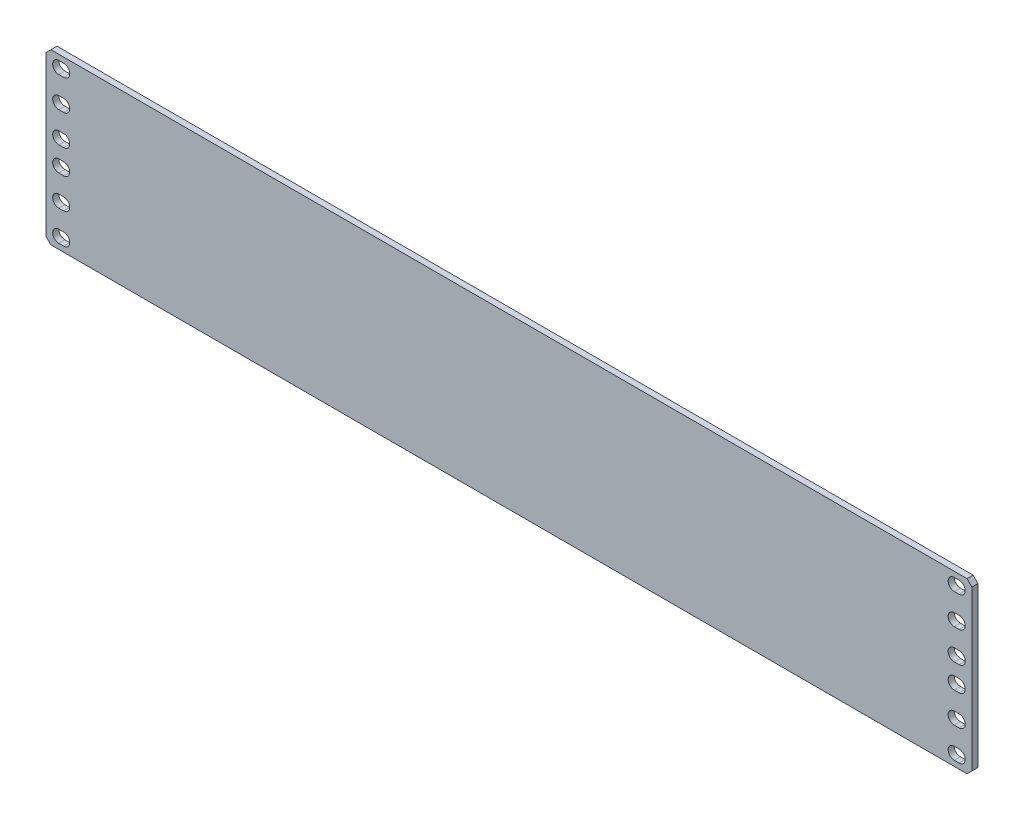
SolidWorks part; units mm, degrees
ref_plane "Front Plane" through (0, 0, 0) normal (0, 0, 1) x (1, 0, 0)
ref_plane "Top Plane" through (0, 0, 0) normal (0, 1, 0) x (1, 0, 0)
ref_plane "Right Plane" through (0, 0, 0) normal (1, 0, 0) x (0, 0, -1)
sketch "Sketch1" plane through (0, 3.175, 0) normal (0, 0, -1) x (1, 0, 0)
  line L1 (-241.3, 47.2281) -> (241.3, 47.2281)
  line L2 (-241.3, 47.2281) -> (-241.3, -40.8781)
  line L3 (-241.3, -40.8781) -> (241.3, -40.8781)
  line L4 (241.3, 47.2281) -> (241.3, -40.8781)
  line L5 (-241.3, 47.2281) -> (241.3, -40.8781) construction
  line L6 (-241.3, -40.8781) -> (241.3, 47.2281) construction
  point P0 (0, 3.175)
  dimension "D1" = 88.1063
  dimension "D2" = 482.6
extrude "Boss-Extrude1" add sketch "Sketch1" against normal blind 3.175
chamfer "Chamfer1" distance 2.54 angle 45 4 edges at (241.3, -44.0531, 1.5875) (241.3, 44.0531, 1.5875) (-241.3, -44.0531, 1.5875) (-241.3, 44.0531, 1.5875)
sketch "Sketch6" plane through (0, 0, 3.175) normal (0, 0, 1) x (1, 0, 0)
  line L0 (-234.6325, -6.35) -> (-232.0925, -6.35) construction
  line L1 (-234.6325, -3.175) -> (-232.0925, -3.175)
  line L2 (-234.6325, -9.525) -> (-232.0925, -9.525)
  line L3 (-234.6325, -38.1) -> (-232.0925, -38.1) construction
  line L4 (-234.6325, -34.925) -> (-232.0925, -34.925)
  line L5 (-234.6325, -41.275) -> (-232.0925, -41.275)
  line L6 (232.0925, -6.35) -> (234.6325, -6.35) construction
  line L7 (232.0925, -3.175) -> (234.6325, -3.175)
  line L8 (232.0925, -9.525) -> (234.6325, -9.525)
  line L9 (232.0925, -38.1) -> (234.6325, -38.1) construction
  line L10 (232.0925, -34.925) -> (234.6325, -34.925)
  line L11 (232.0925, -41.275) -> (234.6325, -41.275)
  line L12 (-234.6325, -22.225) -> (-232.0925, -22.225) construction
  line L13 (-234.6325, -19.05) -> (-232.0925, -19.05)
  line L14 (-241.3, -41.5131) -> (-241.3, 41.5131) construction
  line L15 (238.76, -44.0531) -> (-238.76, -44.0531) construction
  line L16 (-234.6325, -25.4) -> (-232.0925, -25.4)
  line L17 (232.0925, -22.225) -> (234.6325, -22.225) construction
  line L18 (232.0925, -19.05) -> (234.6325, -19.05)
  line L19 (232.0925, -25.4) -> (234.6325, -25.4)
  line L20 (-238.76, 44.0531) -> (238.76, 44.0531) construction
  arc A0 (-234.6325, -3.175) -> (-234.6325, -9.525) centre (-234.6325, -6.35) ccw
  arc A1 (-232.0925, -9.525) -> (-232.0925, -3.175) centre (-232.0925, -6.35) ccw
  arc A2 (-234.6325, -34.925) -> (-234.6325, -41.275) centre (-234.6325, -38.1) ccw
  arc A3 (-232.0925, -41.275) -> (-232.0925, -34.925) centre (-232.0925, -38.1) ccw
  arc A4 (232.0925, -3.175) -> (232.0925, -9.525) centre (232.0925, -6.35) ccw
  arc A5 (234.6325, -9.525) -> (234.6325, -3.175) centre (234.6325, -6.35) ccw
  arc A6 (232.0925, -34.925) -> (232.0925, -41.275) centre (232.0925, -38.1) ccw
  arc A7 (234.6325, -41.275) -> (234.6325, -34.925) centre (234.6325, -38.1) ccw
  arc A8 (-234.6325, -19.05) -> (-234.6325, -25.4) centre (-234.6325, -22.225) ccw
  arc A9 (-232.0925, -25.4) -> (-232.0925, -19.05) centre (-232.0925, -22.225) ccw
  arc A10 (232.0925, -19.05) -> (232.0925, -25.4) centre (232.0925, -22.225) ccw
  arc A11 (234.6325, -25.4) -> (234.6325, -19.05) centre (234.6325, -22.225) ccw
  point P2 (-233.3625, -6.35)
  point P11 (-233.3625, -38.1)
  point P18 (233.3625, -6.35)
  point P21 (-233.3625, -22.225)
  point P26 (233.3625, -38.1)
  point P41 (233.3625, -22.225)
  dimension "D12" = 50.4031
  dimension "D2" = 466.725
  dimension "D3" = 6.35
  dimension "D4" = 8.89
  dimension "D5" = 4.445
  dimension "D6" = 3.175
  dimension "D7" = 2
  dimension "D8" = 15.875
  dimension "D9" = 7.9375
  dimension "D10" = 5.9531
  dimension "D11" = 31.75
extrude "Cut-Extrude2" cut sketch "Sketch6" against normal up to next
pattern_linear "LPattern1" count 2 spacing 44.45 along (0, 1, 0) of "Cut-Extrude2"
